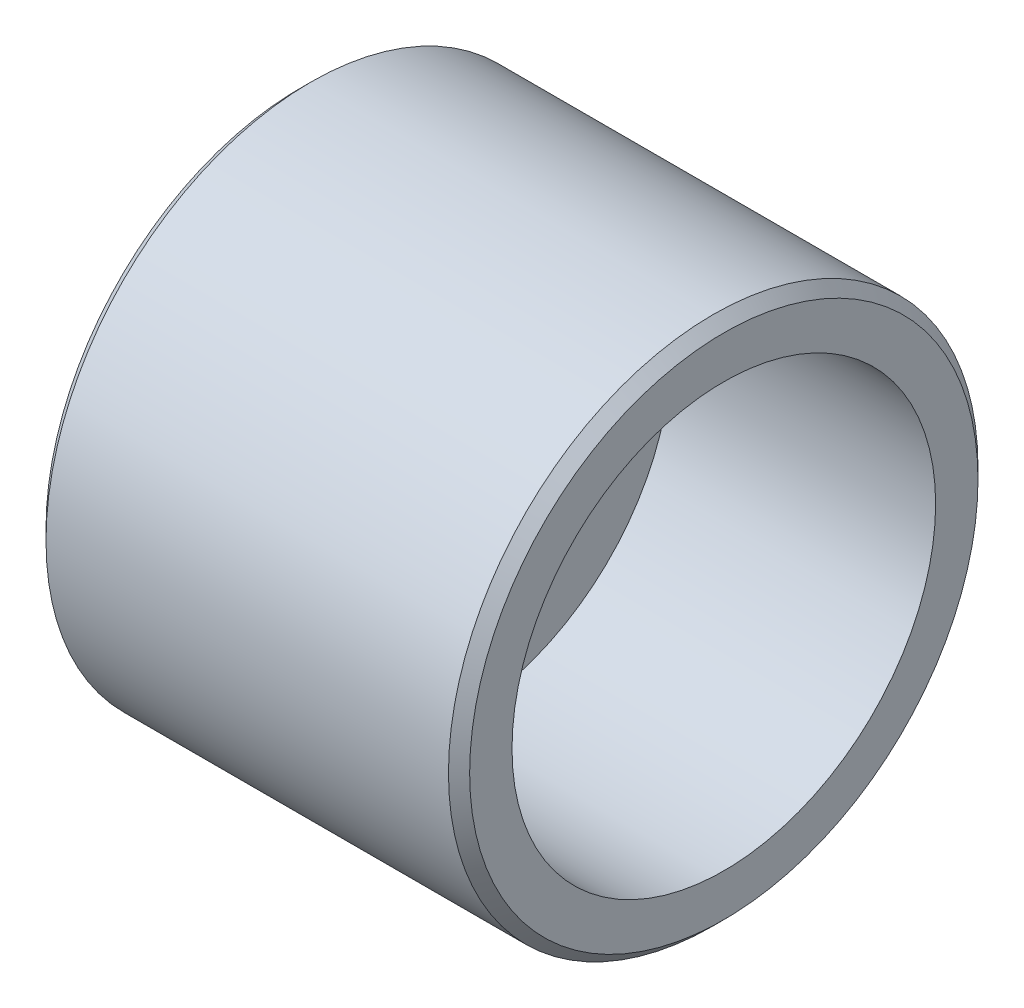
SolidWorks part; units mm, degrees
ref_plane "Plan de face" through (0, 0, 0) normal (0, 0, 1) x (1, 0, 0)
ref_plane "Plan de dessus" through (0, 0, 0) normal (0, 1, 0) x (1, 0, 0)
ref_plane "Plan de droite" through (0, 0, 0) normal (1, 0, 0) x (0, 0, -1)
sketch "Esquisse1" plane through (0, 0, 0) normal (0, 0, 1) x (1, 0, 0)
  line L0 (0, 25) -> (40, 25)
  line L1 (40, 25) -> (40, 20)
  line L2 (40, 20) -> (15, 20)
  line L3 (15, 20) -> (15, 12.5)
  line L4 (15, 12.5) -> (8, 12.5)
  line L5 (8, 12.5) -> (8, 16)
  line L6 (8, 16) -> (0, 16)
  line L7 (0, 16) -> (0, 25)
  line L8 (0, 0) -> (70.3967, 0) construction
  dimension "D1" = 25
  dimension "D2" = 32
  dimension "D3" = 8
  dimension "D4" = 40
  dimension "D5" = 25
  dimension "D6" = 40
  dimension "D7" = 50
revolve "Révolution1" add sketch "Esquisse1" angle 360 about L8
chamfer "Chanfrein1" distance 1 angle 45 2 edges at (0, 0, 25) (40, 0, 25)
